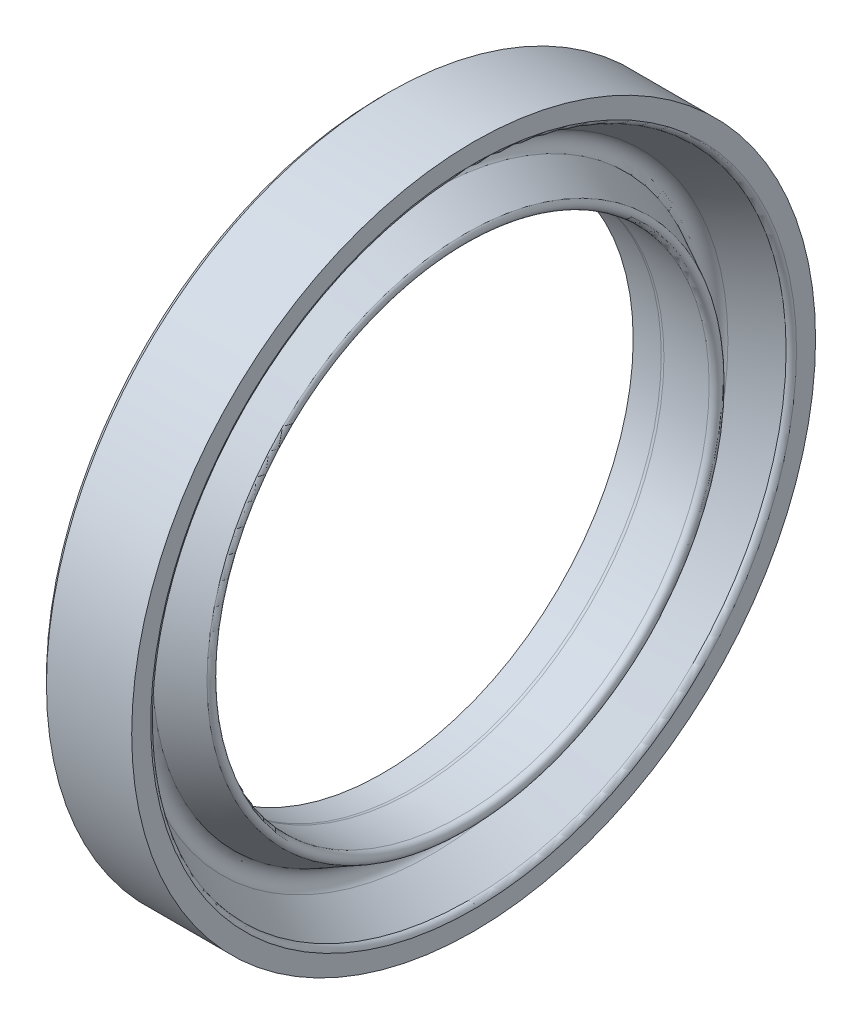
SolidWorks part; units mm, degrees
ref_plane "Plan1" through (0, 0, 0) normal (0, 0, 1) x (1, 0, 0)
ref_plane "Plan2" through (0, 0, 0) normal (0, 1, 0) x (1, 0, 0)
ref_plane "Plan3" through (0, 0, 0) normal (1, 0, 0) x (0, 0, -1)
sketch "Esquisse1" plane through (0, 0, 0) normal (0, 0, 1) x (-1, 0, 0)
  line L0 (9.1, 45.5) -> (9.75, 44.85)
  line L3 (0, 45.5) -> (9.1, 45.5)
  line L4 (0, 45.5) -> (0, 41.8054)
  line L5 (0.325, 41.2425) -> (4.3741, 38.9047)
  line L6 (9.75, 44.85) -> (9.75, 33.8933)
  line L7 (4.5597, 36.783) -> (0.7392, 33.5772)
  line L8 (0, 0) -> (0, 14) construction
  line L9 (-2.434, 0) -> (3.3798, 0) construction
  line L10 (9.75, 33.8933) -> (6.6711, 33.8933)
  line L11 (6.3347, 33.849) -> (1.3, 32.5)
  arc A0 (6.6711, 33.8933) -> (6.3347, 33.849) centre (6.6711, 32.5933) ccw
  arc A1 (4.3741, 38.9047) -> (4.5597, 36.783) centre (3.7241, 37.7789) cw
  arc A2 (0.325, 41.2425) -> (0, 41.8054) centre (0.65, 41.8054) cw
  arc A4 (0.7392, 33.5772) -> (1.3, 32.5) centre (1.139, 33.1008) ccw
  point P10 (2, 10.4287)
  point P13 (1.8406, 11.685)
  point P20 (1.8406, 11.685)
  point P24 (0, 41.4301)
  dimension "D7" = 2
  dimension "D9" = 1.8406
sketch "Esquisse2" plane through (0, 0, 0) normal (0, 0, 1) x (1, 0, 0)
  line L8 (-9.1, -37.5) -> (-9.75, -36.85)
  line L9 (-9.75, -36.85) -> (-9.75, -27.5)
  line L10 (0.25, -37.5) -> (-9.1, -37.5)
  line L11 (0.25, -37.5) -> (0.25, -35.412)
  line L12 (-0.325, -34.8491) -> (-4.3741, -32.5114)
  line L13 (-4.5597, -30.3897) -> (-0.636, -28.356)
  line L14 (-6.3347, -27.4557) -> (-1.1968, -27.2787)
  line L15 (-9.75, -27.5) -> (-6.6711, -27.5)
  line L16 (2.434, 0) -> (-3.3798, 0) construction
  arc A4 (0.25, -35.412) -> (-0.325, -34.8491) centre (-0.3946, -35.4954) ccw
  arc A5 (-6.6711, -27.5) -> (-6.3347, -27.4557) centre (-6.6711, -26.2) ccw
  arc A6 (-4.5597, -30.3897) -> (-4.3741, -32.5114) centre (-3.7241, -31.3855) ccw
  arc A7 (-0.636, -28.356) -> (-1.1968, -27.2787) centre (-1.0358, -27.8795) ccw
  dimension "D1" = 27.5
  dimension "D2" = 37.5
  dimension "D3" = 10
revolve "Révolution2" add sketch "Esquisse2" angle 360 about L9
